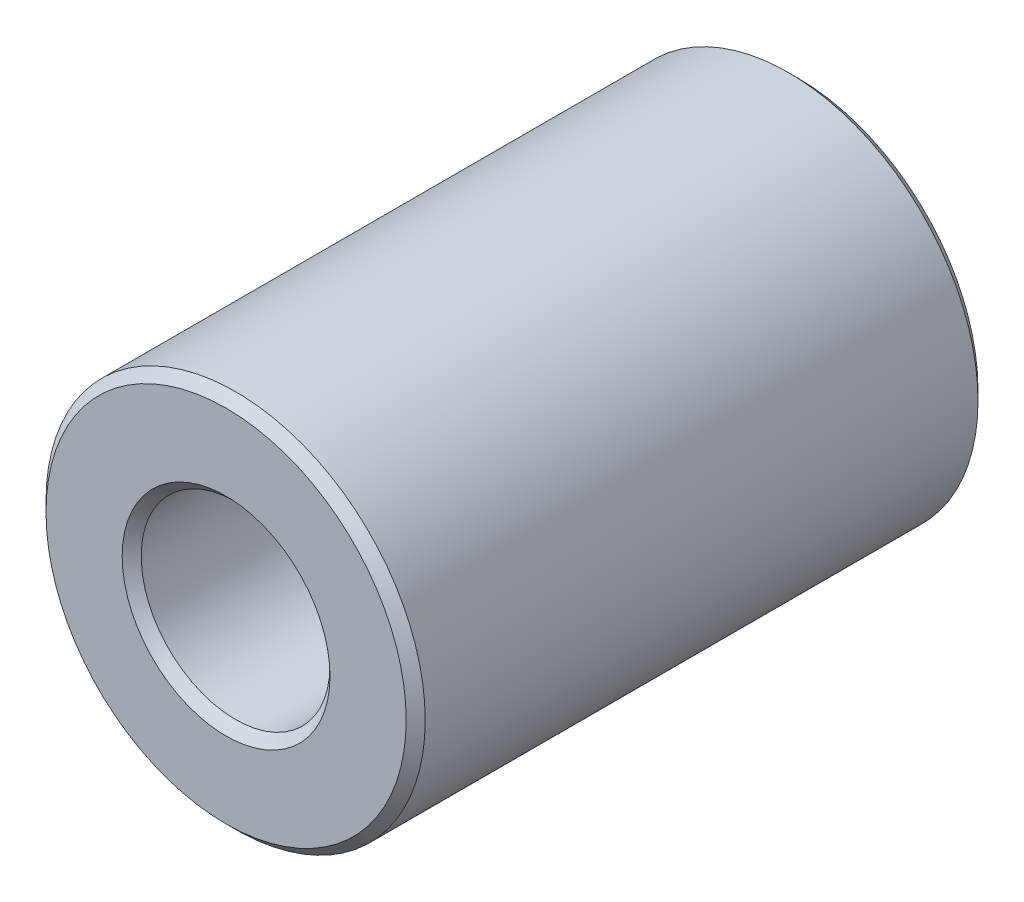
SolidWorks part; units mm, degrees
ref_plane "Front Plane" through (0, 0, 0) normal (0, 0, 1) x (1, 0, 0)
ref_plane "Top Plane" through (0, 0, 0) normal (0, 1, 0) x (1, 0, 0)
ref_plane "Right Plane" through (0, 0, 0) normal (1, 0, 0) x (0, 0, -1)
sketch "Sketch1" plane through (0, 0, 0) normal (0, 0, 1) x (1, 0, 0)
  circle A0 centre (0, 0) radius 5 construction
  circle A1 centre (0, 0) radius 2.4892 construction
  point P4 (0, 5)
sketch "Sketch2" plane through (0, 0, 0) normal (1, 0, 0) x (0, 0, -1)
  line L0 (-7.54, 5) -> (7.54, 5) construction
  dimension "Length" = 15.08
sketch "Sketch3" plane through (0, 0, 0) normal (0, 0, 1) x (1, 0, 0)
  circle A0 centre (0, 0) radius 2.4892 construction
  circle A1 centre (0, 0) radius 5 construction
  circle A2 centre (0, 0) radius 2.4892
  circle A3 centre (0, 0) radius 5
extrude "Boss-Extrude1" add sketch "Sketch3" against normal up to vertex (7.54 mm away) and the other way up to vertex (7.54 mm away)
chamfer "Chamfer1" distance 0.2511 angle 45 4 edges at (5, 0, 7.54) (5, 0, -7.54) (2.4892, 0, 7.54) (2.4892, 0, -7.54)
equation "\"D1@Chamfer1\"=(\"OD@Sketch1\"-\"ID@Sketch1\")*0.05"
